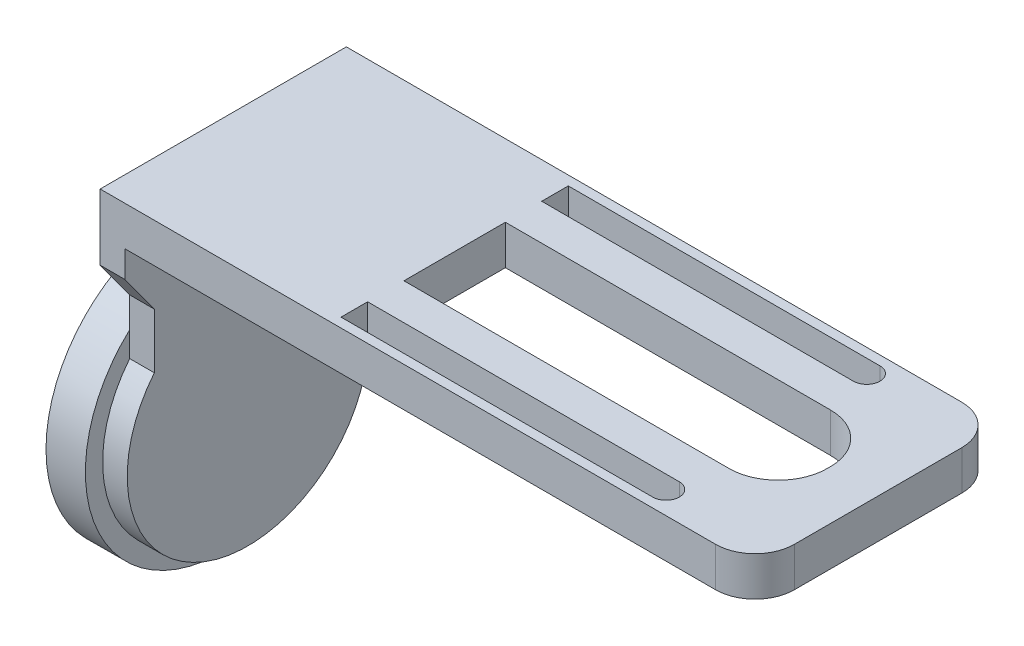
SolidWorks part; units mm, degrees
ref_plane "Front Plane" through (0, 0, 0) normal (0, 0, 1) x (1, 0, 0)
ref_plane "Top Plane" through (0, 0, 0) normal (0, 1, 0) x (1, 0, 0)
ref_plane "Right Plane" through (0, 0, 0) normal (1, 0, 0) x (0, 0, -1)
sketch "Sketch1" plane through (0, 0, 0) normal (0, 1, 0) x (1, 0, 0)
  line L0 (0, -12.5) -> (124.8949, -12.5) construction
  line L1 (0, 0) -> (62.5, 0)
  line L2 (0, 0) -> (0, -25)
  line L3 (0, -25) -> (62.5, -25)
  line L4 (66.5, -4) -> (66.5, -21)
  line L5 (23.5, -7.35) -> (56.51, -7.35)
  line L6 (23.5, -7.35) -> (23.5, -17.65)
  line L7 (23.5, -17.65) -> (56.51, -17.65)
  line L8 (61.5, -12.34) -> (61.5, -12.66)
  line L9 (23.5, -0.96) -> (55.151, -0.96)
  line L10 (23.5, -0.96) -> (23.5, -3.66)
  line L11 (23.5, -3.66) -> (55.151, -3.66)
  line L12 (56.5, -2.309) -> (56.5, -2.311)
  line L13 (23.5, -21.34) -> (55.151, -21.34)
  line L14 (56.5, -22.691) -> (56.5, -22.689)
  line L15 (23.5, -24.04) -> (55.151, -24.04)
  line L16 (23.5, -24.04) -> (23.5, -21.34)
  arc A0 (56.51, -17.65) -> (61.5, -12.66) centre (56.51, -12.66) ccw
  arc A1 (56.51, -7.35) -> (61.5, -12.34) centre (56.51, -12.34) cw
  arc A2 (55.151, -3.66) -> (56.5, -2.311) centre (55.151, -2.311) ccw
  arc A3 (55.151, -0.96) -> (56.5, -2.309) centre (55.151, -2.309) cw
  arc A4 (56.5, -22.691) -> (55.151, -24.04) centre (55.151, -22.691) cw
  arc A5 (55.151, -21.34) -> (56.5, -22.689) centre (55.151, -22.689) cw
  arc A6 (62.5, -25) -> (66.5, -21) centre (62.5, -21) ccw
  arc A7 (62.5, 0) -> (66.5, -4) centre (62.5, -4) cw
  point P21 (61.5, -17.65)
  point P24 (61.5, -7.35)
  point P27 (56.5, -3.66)
  point P30 (56.5, -0.96)
  point P33 (56.5, -24.04)
  point P36 (56.5, -21.34)
  point P41 (66.5, 0)
  dimension "D9" = 4.99
  dimension "D10" = 1.349
  dimension "D11" = 1.349
  dimension "D13" = 4
  dimension "D1" = 25
  dimension "D2" = 66.5
  dimension "D3" = 5
  dimension "D4" = 38
  dimension "D5" = 5.15
  dimension "D6" = 2.7
  dimension "D7" = 3.69
  dimension "D8" = 10
  dimension "D12" = 5.15
  dimension "D14" = 0
extrude "Boss-Extrude1" add sketch "Sketch1" along normal blind 4
sketch "Sketch2" plane through (0, 0, 0) normal (-1, 0, 0) x (0, 0, 1)
  line L1 (12.5, 0) -> (12.5, -32.4) construction
  line L2 (0, 0) -> (25, 0) construction
  line L3 (3, -6.8161) -> (3, -12.4161)
  line L4 (0, 0) -> (0, -2.7)
  line L5 (0, -2.7) -> (3, -6.8161)
  line L6 (25, 0) -> (0, 0)
  line L7 (25, 0) -> (25, -2.7)
  line L8 (25, -2.7) -> (22, -6.8161)
  line L9 (22, -6.8161) -> (22, -12.4161)
  arc A0 (3, -12.4161) -> (22, -12.4161) centre (12.5, -20.15) ccw
  dimension "D2" = 24.5
  dimension "D1" = 32.4
  dimension "D3" = 9.5
  dimension "D4" = 2.7
  dimension "D5" = 5.6
extrude "Boss-Extrude2" add sketch "Sketch2" against normal blind 2.5
sketch "Sketch3" plane through (0, 0, 0) normal (-1, 0, 0) x (0, 0, 1)
  circle A0 centre (12.5, -20.15) radius 14
  arc A1 (3, -12.4161) -> (22, -12.4161) centre (12.5, -20.15) ccw construction
extrude "Boss-Extrude3" add sketch "Sketch3" along normal blind 4
